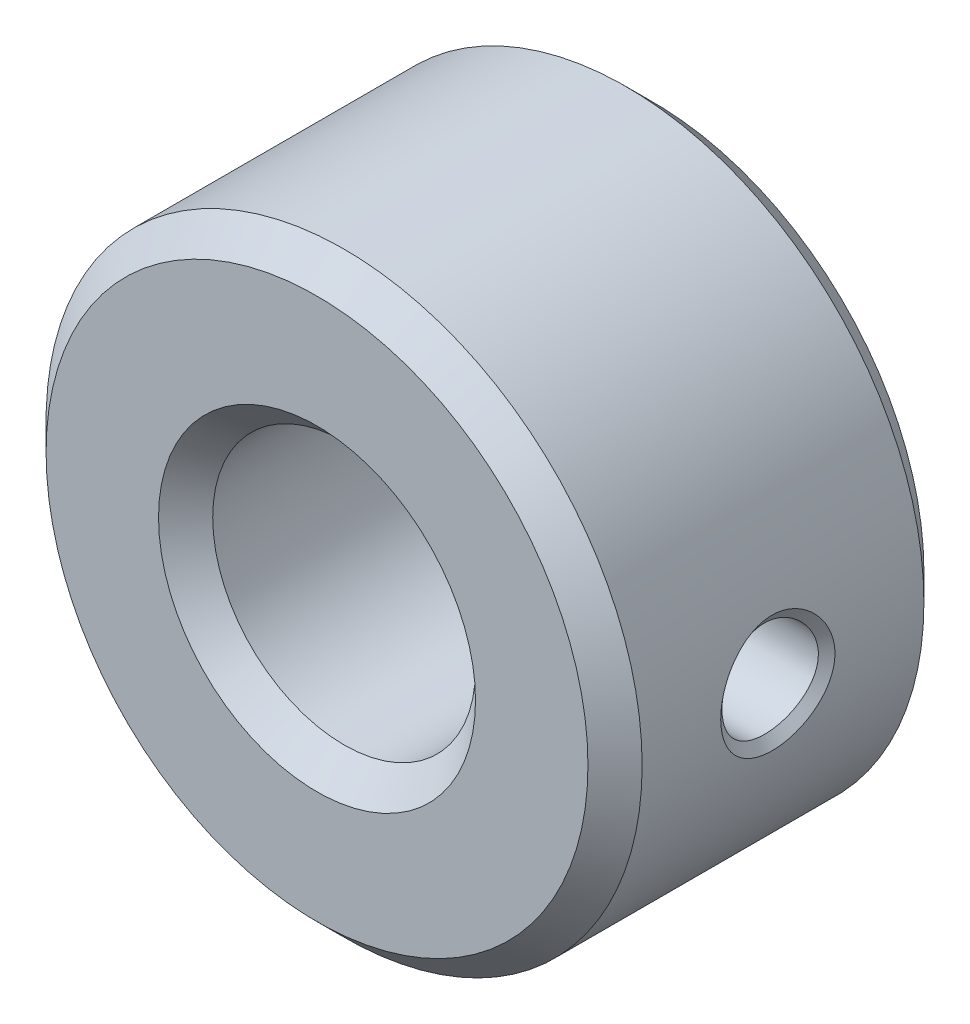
SolidWorks part; units mm, degrees
ref_plane "Front Plane" through (0, 0, 0) normal (0, 0, 1) x (1, 0, 0)
ref_plane "Top Plane" through (0, 0, 0) normal (0, 1, 0) x (1, 0, 0)
ref_plane "Right Plane" through (0, 0, 0) normal (1, 0, 0) x (0, 0, -1)
sketch "Sketch1" plane through (0, 0, 0) normal (0, 0, 1) x (1, 0, 0)
  circle A0 centre (0, 0) radius 5.5
  dimension "D1" = 11
extrude "Extrude1" add sketch "Sketch1" against normal blind 6.2
sketch "Sketch2" plane through (0, 0, 0) normal (0, 0, 1) x (1, 0, 0)
  circle A0 centre (0, 0) radius 2.425
  dimension "D1" = 4.85
extrude "Cut-Extrude1" cut sketch "Sketch2" against normal through all
chamfer "Chamfer3" distance 0.5 angle 45 2 edges at (5.5, 0, 0) (2.425, 0, 0)
chamfer "Chamfer5" distance 0.5 angle 45 2 edges at (5.5, 0, -6.2) (2.425, 0, -6.2)
hole_wizard "#2-56 Tapped Hole1" positions "3DSketch1" profile "Sketch3" tap size "#2-56" standard "Ansi Inch"
sketch3d "3DSketch1"
  point P0 (5.5, 0.0106, -3.0047)
sketch "Sketch3" plane through (5.5, 0.0106, -3.0047) normal (0, 0, 1) x (-0.0019, 1, 0)
  line L0 (0, 0) -> (0, 7.1742)
  line L1 (0, 7.1742) -> (0.889, 6.64)
  line L2 (0.889, 6.64) -> (0.889, 0)
  line L5 (0.889, 0) -> (0, 0)
  line L10 (0, 7.1742) -> (-0.889, 6.64) construction
  line L11 (0, -6.35) -> (0, 107.95) construction
  dimension "Tap Drill Dia." = 1.778
  dimension "Tap Drill Depth" = 6.64
  dimension "Drill Angle" = 118
chamfer "Chamfer6" distance 0.2 angle 45 1 edges at (5.4974, -0.1704, -2.1343)
